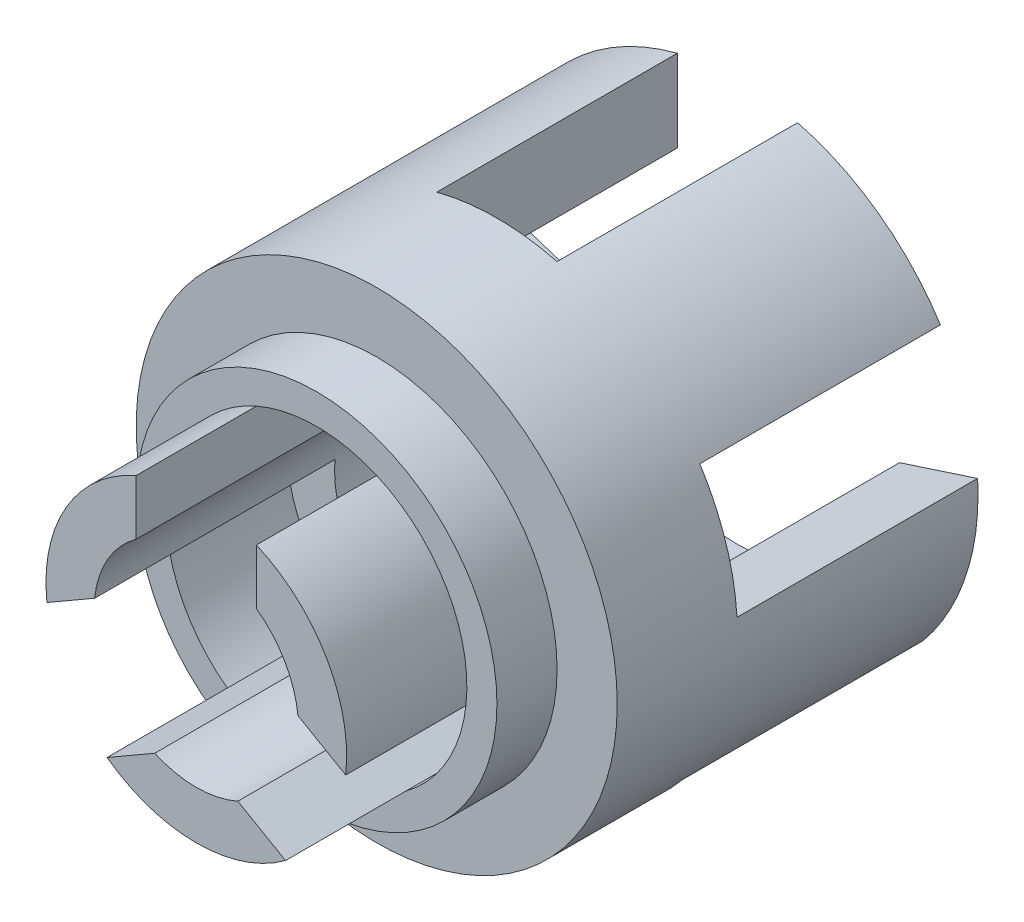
SolidWorks part; units mm, degrees
ref_plane "Front Plane" through (0, 0, 0) normal (0, 0, 1) x (1, 0, 0)
ref_plane "Top Plane" through (0, 0, 0) normal (0, 1, 0) x (1, 0, 0)
ref_plane "Right Plane" through (0, 0, 0) normal (1, 0, 0) x (0, 0, -1)
sketch "Sketch1" plane through (0, 0, 0) normal (0, 0, 1) x (1, 0, 0)
  circle A0 centre (0, 0) radius 5.08
  dimension "D1" = 10.16
extrude "Boss-Extrude1" add sketch "Sketch1" against normal blind 7.62
sketch "Sketch2" plane through (0, 0, 0) normal (0, 0, 1) x (1, 0, 0)
  line L0 (-1.27, 2.9099) -> (-1.27, 0.8424)
  line L1 (0, 0) -> (0, 4.3222) construction
  line L2 (1.27, 2.9099) -> (1.27, 0.8424)
  line L3 (3.1551, -0.3551) -> (1.3646, 0.6786)
  line L4 (1.8851, -2.5548) -> (0.0946, -1.5211)
  line L5 (-1.8851, -2.5548) -> (-0.0946, -1.5211)
  line L6 (-3.1551, -0.3551) -> (-1.3646, 0.6786)
  circle A0 centre (0, 0) radius 3.81
  arc A1 (-3.1551, -0.3551) -> (-1.8851, -2.5548) centre (0, 0) ccw
  arc A2 (1.27, 0.8424) -> (-1.27, 0.8424) centre (0, 0) ccw
  arc A3 (0.0946, -1.5211) -> (1.3646, 0.6786) centre (0, 0) ccw
  arc A4 (-1.3646, 0.6786) -> (-0.0946, -1.5211) centre (0, 0) ccw
  circle A5 centre (0, 0) radius 1.524
  arc A6 (1.27, 2.9099) -> (-1.27, 2.9099) centre (0, 0) ccw
  arc A7 (1.8851, -2.5548) -> (3.1551, -0.3551) centre (0, 0) ccw
  point P19 (0, 0)
  dimension "D1" = 7.62
  dimension "D2" = 6.35
  dimension "D3" = 3.048
  dimension "D4" = 1.27
  dimension "D5" = 1.27
  dimension "D6" = 3
extrude "Boss-Extrude2" add sketch "Sketch2" along normal blind 1.27
sketch "Sketch3" plane through (0, 0, -7.62) normal (0, 0, -1) x (-1, 0, 0)
  circle A0 centre (0, 0) radius 2.159
  dimension "D1" = 4.318
extrude "Cut-Extrude1" cut sketch "Sketch3" against normal through all
sketch "Sketch4" plane through (0, 0, -7.62) normal (0, 0, -1) x (-1, 0, 0)
  circle A0 centre (0, 0) radius 3.429
  dimension "D1" = 6.858
extrude "Cut-Extrude2" cut sketch "Sketch4" against normal blind 5.08
sketch "Sketch5" plane through (0, 0, -7.62) normal (0, 0, -1) x (-1, 0, 0)
  line L0 (0, 0) -> (0, 5.8522) construction
  line L2 (-1.27, 4.9187) -> (-1.27, 2.9099)
  line L4 (1.27, 4.9187) -> (1.27, 2.9099)
  line L5 (4.2855, 2.7278) -> (2.3751, 2.1071)
  line L7 (5.0704, 0.3121) -> (3.16, -0.3086)
  line L9 (3.9186, -3.2328) -> (2.7379, -1.6077)
  line L11 (1.8637, -4.7258) -> (0.683, -3.1007)
  line L13 (-1.8637, -4.7258) -> (-0.683, -3.1007)
  line L15 (-3.9186, -3.2328) -> (-2.7379, -1.6077)
  line L17 (-5.0704, 0.3121) -> (-3.16, -0.3086)
  line L19 (-4.2855, 2.7278) -> (-2.3751, 2.1071)
  arc A10 (-2.3751, 2.1071) -> (-1.27, 2.9099) centre (0, 0) ccw
  arc A11 (1.27, 4.9187) -> (-1.27, 4.9187) centre (0, 0) ccw
  arc A12 (-4.2855, 2.7278) -> (4.2855, 2.7278) centre (0, 0) ccw
  point P25 (0, 0)
  dimension "D1" = 2.54
  dimension "D2" = 1.27
  dimension "D3" = 5
extrude "Cut-Extrude4" cut sketch "Sketch5" against normal blind 5.08 contours L0 A11 L2 M21 | L0 A10 L4 M22 | L19 L17 M22 M21 | L15 L13 M22 M21 | L11 L9 M22 M21 | L7 L5 M22 M21
sketch "Sketch6" plane through (0, 0, 1.27) normal (0, 0, 1) x (1, 0, 0)
  line L0 (-1.27, 1.746) -> (-1.27, 2.9099)
  line L1 (1.27, 1.746) -> (1.27, 2.9099)
  line L2 (2.147, 0.2269) -> (3.1551, -0.3551)
  line L3 (0.877, -1.9728) -> (1.8851, -2.5548)
  line L4 (-0.877, -1.9728) -> (-1.8851, -2.5548)
  line L5 (-2.147, 0.2269) -> (-3.1551, -0.3551)
  arc A0 (-1.27, 2.9099) -> (-3.1551, -0.3551) centre (0, 0) ccw
  arc A1 (-1.27, 1.746) -> (-2.147, 0.2269) centre (0, 0) ccw
  arc A2 (-1.8851, -2.5548) -> (1.8851, -2.5548) centre (0, 0) ccw
  arc A3 (-0.877, -1.9728) -> (0.877, -1.9728) centre (0, 0) ccw
  arc A4 (2.147, 0.2269) -> (1.27, 1.746) centre (0, 0) ccw
  arc A5 (3.1551, -0.3551) -> (1.27, 2.9099) centre (0, 0) ccw
extrude "Boss-Extrude3" add sketch "Sketch6" along normal blind 2.54
sketch "Sketch7" plane through (0, 0, 0) normal (0, 0, 1) x (1, 0, 0)
  line L0 (1.27, 1.746) -> (1.27, 2.9099)
  line L1 (2.147, 0.2269) -> (3.1551, -0.3551)
  line L2 (-1.27, 1.746) -> (-1.27, 2.9099)
  line L3 (-2.147, 0.2269) -> (-3.1551, -0.3551)
  line L4 (-0.877, -1.9728) -> (-1.8851, -2.5548)
  line L5 (0.877, -1.9728) -> (1.8851, -2.5548)
  arc A0 (1.27, 2.9099) -> (-1.27, 2.9099) centre (0, 0) ccw
  arc A1 (1.27, 1.746) -> (-1.27, 1.746) centre (0, 0) ccw
  arc A2 (-2.147, 0.2269) -> (-0.877, -1.9728) centre (0, 0) ccw
  arc A3 (-3.1551, -0.3551) -> (-1.8851, -2.5548) centre (0, 0) ccw
  arc A4 (1.8851, -2.5548) -> (3.1551, -0.3551) centre (0, 0) ccw
  arc A5 (0.877, -1.9728) -> (2.147, 0.2269) centre (0, 0) ccw
extrude "Cut-Extrude5" cut sketch "Sketch7" against normal blind 1.27
